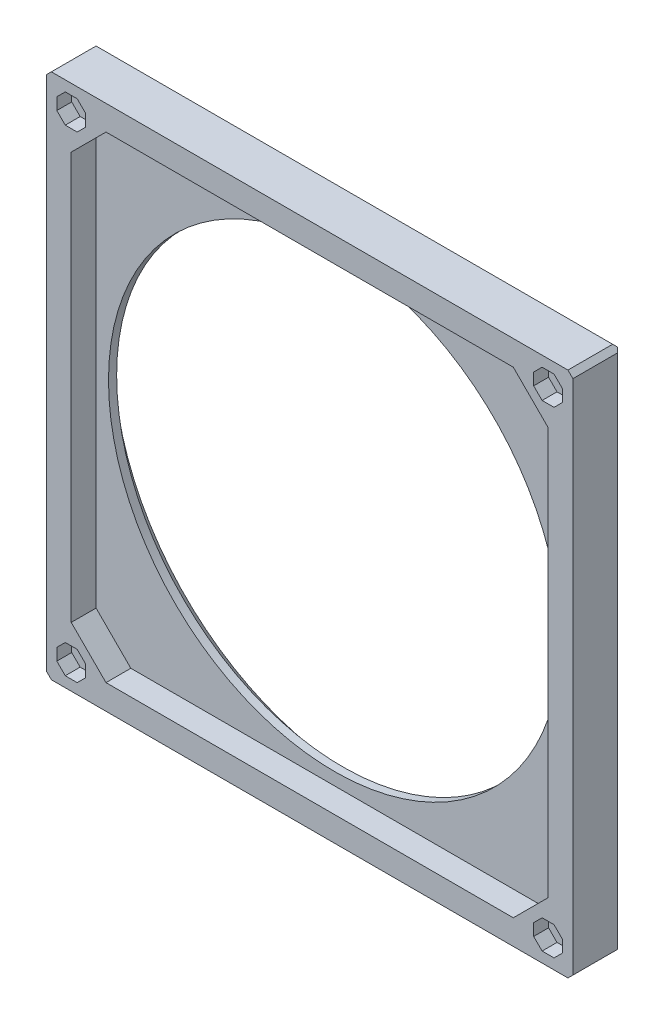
SolidWorks part; units mm, degrees
ref_plane "Front Plane" through (0, 0, 0) normal (0, 0, 1) x (1, 0, 0)
ref_plane "Top Plane" through (0, 0, 0) normal (0, 1, 0) x (1, 0, 0)
ref_plane "Right Plane" through (0, 0, 0) normal (1, 0, 0) x (0, 0, -1)
sketch "Sketch1 larger dia" plane through (0, 0, 0) normal (0, 0, 1) x (1, 0, 0)
  line L0 (-41, 48) -> (41, 48)
  line L1 (-53, 53) -> (53, 53)
  line L2 (-53, 53) -> (-53, -53)
  line L3 (-53, -53) -> (53, -53)
  line L4 (53, 53) -> (53, -53)
  line L5 (41, 48) -> (48, 41)
  line L6 (48, 41) -> (48, -41)
  line L7 (48, -41) -> (41, -48)
  line L8 (41, -48) -> (-41, -48)
  line L9 (-41, -48) -> (-48, -41)
  line L10 (-48, -41) -> (-48, 41)
  line L11 (-48, 41) -> (-41, 48)
  dimension "D2" = 12
  dimension "D3" = 5
  dimension "D4" = 5
  dimension "D5" = 5
  dimension "D6" = 5
  dimension "D8" = 12
  dimension "D9" = 12
  dimension "D10" = 12
  dimension "D11" = 12
  dimension "D12" = 12
sketch "Sketch3 holes" plane through (0, 0, 0) normal (0, 0, 1) x (1, 0, 0)
  line L1 (-53, 53) -> (53, 53) construction
  line L2 (-53, 53) -> (-53, -53) construction
  line L3 (-53, -53) -> (53, -53) construction
  line L4 (53, 53) -> (53, -53) construction
  circle A0 centre (-48, 48) radius 1.5
  circle A1 centre (48, 48) radius 1.5
  circle A2 centre (-48, -48) radius 1.5
  circle A3 centre (48, -48) radius 1.5
  dimension "D1" = 5
  dimension "D3" = 3
  dimension "D6" = 3
  dimension "D9" = 3
  dimension "D12" = 3
  dimension "D2" = 5
  dimension "D4" = 5
  dimension "D5" = 5
  dimension "D7" = 5
  dimension "D8" = 5
  dimension "D10" = 5
  dimension "D11" = 5
sketch "Sketch4 ring" plane through (0, 0, 0) normal (0, 0, 1) x (1, 0, 0)
  circle A0 centre (0, 0) radius 47.75
  circle A1 centre (0, 0) radius 45.5
  dimension "D1" = 95.5
  dimension "D2" = 91
extrude "Boss-Extrude1" add sketch "Sketch1 larger dia" along normal blind 5
sketch "Sketch5 smaller dia" plane through (0, 0, 0) normal (0, 0, -1) x (-1, 0, 0)
  line L1 (-53, 53) -> (53, 53)
  line L2 (-53, 53) -> (-53, -53)
  line L3 (-53, -53) -> (53, -53)
  line L4 (53, 53) -> (53, -53)
  circle A0 centre (0, 0) radius 45.5
  dimension "D1" = 91
extrude "Boss-Extrude2" add sketch "Sketch5 smaller dia" along normal blind 5
sketch "Sketch1" plane through (0, 0, 5) normal (0, 0, 1) x (1, 0, 0)
  line L0 (0, 53) -> (0, -53) construction
  line L1 (-53, 53) -> (53, 53) construction
  line L2 (-53, 53) -> (-53, -53) construction
  line L3 (-53, -53) -> (53, -53) construction
  line L4 (53, 53) -> (53, -53) construction
  line L5 (-45.1, 46.7988) -> (-45.1, 49.2012)
  line L6 (-45.1, 49.2012) -> (-46.7988, 50.9)
  line L7 (-46.7988, 50.9) -> (-49.2012, 50.9)
  line L8 (-49.2012, 50.9) -> (-50.9, 49.2012)
  line L9 (-50.9, 49.2012) -> (-50.9, 46.7988)
  line L10 (-50.9, 46.7988) -> (-49.2012, 45.1)
  line L11 (-49.2012, 45.1) -> (-46.7988, 45.1)
  line L12 (-46.7988, 45.1) -> (-45.1, 46.7988)
  line L13 (-53, 0) -> (53, 0) construction
  line L14 (-46.7988, -45.1) -> (-45.1, -46.7988)
  line L15 (-49.2012, -45.1) -> (-46.7988, -45.1)
  line L16 (-50.9, -46.7988) -> (-49.2012, -45.1)
  line L17 (-50.9, -49.2012) -> (-50.9, -46.7988)
  line L18 (-49.2012, -50.9) -> (-50.9, -49.2012)
  line L19 (-46.7988, -50.9) -> (-49.2012, -50.9)
  line L20 (-45.1, -49.2012) -> (-46.7988, -50.9)
  line L21 (-45.1, -46.7988) -> (-45.1, -49.2012)
  line L22 (46.7988, 45.1) -> (45.1, 46.7988)
  line L23 (49.2012, 45.1) -> (46.7988, 45.1)
  line L24 (50.9, 46.7988) -> (49.2012, 45.1)
  line L25 (50.9, 49.2012) -> (50.9, 46.7988)
  line L26 (49.2012, 50.9) -> (50.9, 49.2012)
  line L27 (46.7988, 50.9) -> (49.2012, 50.9)
  line L28 (45.1, 49.2012) -> (46.7988, 50.9)
  line L29 (45.1, 46.7988) -> (45.1, 49.2012)
  line L30 (45.1, -46.7988) -> (45.1, -49.2012)
  line L31 (45.1, -49.2012) -> (46.7988, -50.9)
  line L32 (46.7988, -50.9) -> (49.2012, -50.9)
  line L33 (49.2012, -50.9) -> (50.9, -49.2012)
  line L34 (50.9, -49.2012) -> (50.9, -46.7988)
  line L35 (50.9, -46.7988) -> (49.2012, -45.1)
  line L36 (49.2012, -45.1) -> (46.7988, -45.1)
  line L37 (46.7988, -45.1) -> (45.1, -46.7988)
  circle A4 centre (-48, 48) radius 2.9 construction
  circle A5 centre (-48, -48) radius 2.9 construction
  circle A6 centre (48, 48) radius 2.9 construction
  circle A7 centre (48, -48) radius 2.9 construction
  dimension "D3" = 5
  dimension "D13" = 5.8
  dimension "D2" = 5
  dimension "D4" = 106
extrude "Cut-Extrude1" cut sketch "Sketch1" against normal blind 3
chamfer "Chamfer1" distance 4 angle 40 1 edges at (-45.5, 0, -5)
chamfer "Chamfer2" distance 1 4 edges at (0, -53, -5) (53, 0, -5) (0, 53, -5) (-53, 0, -5)
chamfer "Chamfer3" distance 1 angle 45 4 edges at (53, -53, 0.5) (-53, -53, 0.5) (-53, 53, 0.5) (53, 53, 0.5)
